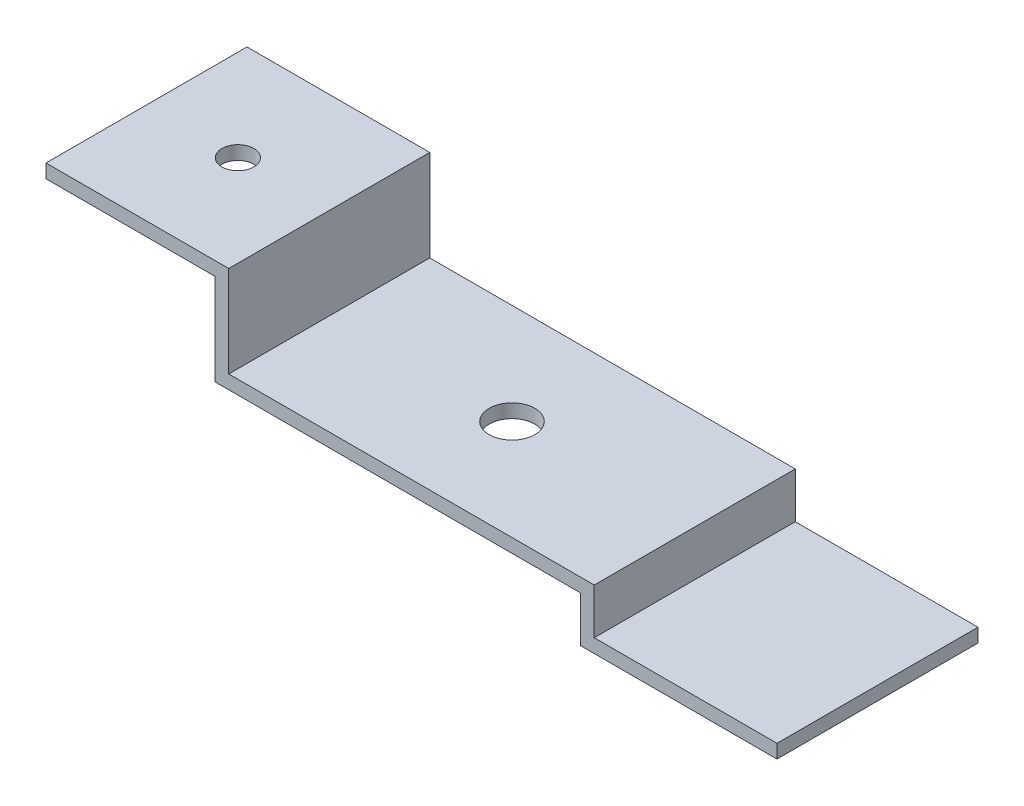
SolidWorks part; units mm, degrees
ref_plane "Front" through (0, 0, 0) normal (0, 0, 1) x (1, 0, 0)
ref_plane "Top" through (0, 0, 0) normal (0, 1, 0) x (1, 0, 0)
ref_plane "Right" through (0, 0, 0) normal (1, 0, 0) x (0, 0, -1)
sketch "Sketch1" plane through (0, 0, 0) normal (0, 0, 1) x (1, 0, 0)
  line L0 (0, 0) -> (-21.5, 0)
  line L1 (-21.5, 0) -> (-21.5, 5)
  line L2 (-21.5, 5) -> (-61.5, 5)
  line L3 (-61.5, 5) -> (-61.5, 15)
  line L4 (-61.5, 15) -> (-80, 15)
  line L5 (-80, 15) -> (-80, 16.5)
  line L6 (-80, 16.5) -> (-60, 16.5)
  line L7 (-60, 16.5) -> (-60, 6.5)
  line L8 (-60, 6.5) -> (-20, 6.5)
  line L9 (-20, 6.5) -> (-20, 1.5)
  line L10 (-20, 1.5) -> (0, 1.5)
  line L11 (0, 1.5) -> (0, 0)
extrude "Extrude1" add sketch "Sketch1" along normal blind 22
sketch "Sketch2" plane through (0, 16.5, 0) normal (0, 1, 0) x (-1, 0, 0)
  circle A0 centre (70, 11) radius 1.75
extrude "Cut-Extrude1" cut sketch "Sketch2" against normal blind 22
sketch "Sketch3" plane through (0, 6.5, 0) normal (0, 1, 0) x (-1, 0, 0)
  circle A0 centre (40, 11) radius 2.5
extrude "Cut-Extrude2" cut sketch "Sketch3" against normal blind 22
